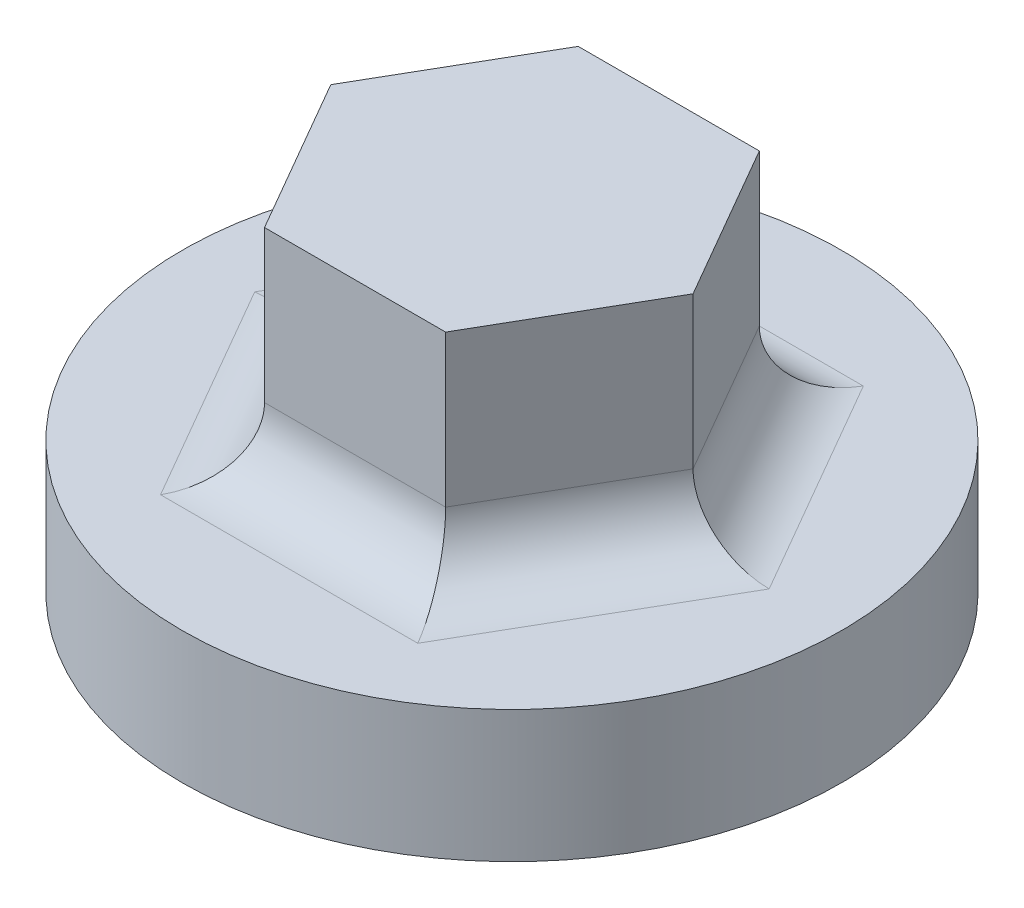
SolidWorks part; units mm, degrees
ref_plane "Front" through (0, 0, 0) normal (0, 0, 1) x (1, 0, 0)
ref_plane "Top" through (0, 0, 0) normal (0, 1, 0) x (1, 0, 0)
ref_plane "Right" through (0, 0, 0) normal (1, 0, 0) x (0, 0, -1)
sketch "Sketch1" plane through (0, 0, 0) normal (0, 1, 0) x (1, 0, 0)
  circle A0 centre (0, 0) radius 50
  dimension "D1" = 100
extrude "Extrude1" add sketch "Sketch1" along normal blind 20
sketch "Sketch2" plane through (0, 20, 0) normal (0, 1, 0) x (-1, 0, 0)
  line L0 (27.4795, 0) -> (13.7397, 23.7979)
  line L1 (13.7397, 23.7979) -> (-13.7397, 23.7979)
  line L2 (-13.7397, 23.7979) -> (-27.4795, 0)
  line L3 (-27.4795, 0) -> (-13.7397, -23.7979)
  line L4 (-13.7397, -23.7979) -> (13.7397, -23.7979)
  line L5 (13.7397, -23.7979) -> (27.4795, 0)
  circle A0 centre (0, 0) radius 23.7979 construction
extrude "Extrude2" add sketch "Sketch2" along normal blind 33
fillet "Fillet3" radius 10 6 edges at (-20.6096, 20, 11.899) (-20.6096, 20, -11.899) (0, 20, -23.7979) (20.6096, 20, -11.899) (0, 20, 23.7979) (20.6096, 20, 11.899)
